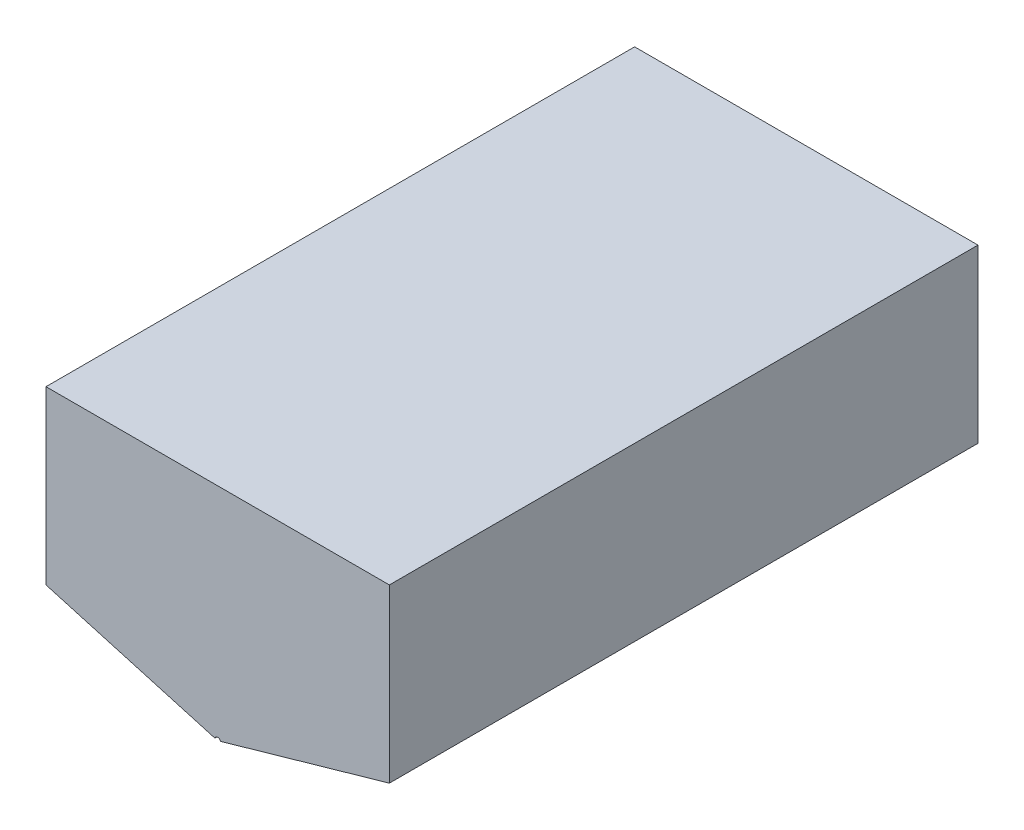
SolidWorks part; units mm, degrees
ref_plane "Plano frontal" through (0, 0, 0) normal (0, 0, 1) x (1, 0, 0)
ref_plane "Plano superior" through (0, 0, 0) normal (0, 1, 0) x (1, 0, 0)
ref_plane "Plano direito" through (0, 0, 0) normal (1, 0, 0) x (0, 0, -1)
sketch "Esboço1" plane through (0, 0, 0) normal (0, 0, 1) x (1, 0, 0)
  line L2 (35, -12.5) -> (35, 22.5)
  line L3 (35, 22.5) -> (-35, 22.5)
  line L4 (-35, -12.5) -> (-35, 22.5)
  line L5 (24.2308, -15.5769) -> (-35, 22.5) construction
  line L6 (35, 22.5) -> (-24.2308, -15.5769) construction
  line L7 (-0.3846, -22.3901) -> (-35, -12.5)
  line L8 (0.3846, -22.3901) -> (35, -12.5)
  arc A0 (0.3846, -22.3901) -> (-0.3846, -22.3901) centre (0, -22.5) ccw
  point P0 (0, 0)
  point P2 (35, -22.5)
  point P4 (-35, -22.5)
  dimension "D2" = 0.8
  dimension "D1" = 70
extrude "Ressalto-extrusão1" add sketch "Esboço1" along normal blind 120
sketch "Esboço3" plane through (0, 0, 120) normal (0, 0, 1) x (1, 0, 0)
  circle A1 centre (0, -22.5) radius 0.6
extrude "Corte-extrusão1" cut sketch "Esboço3" against normal blind 30
